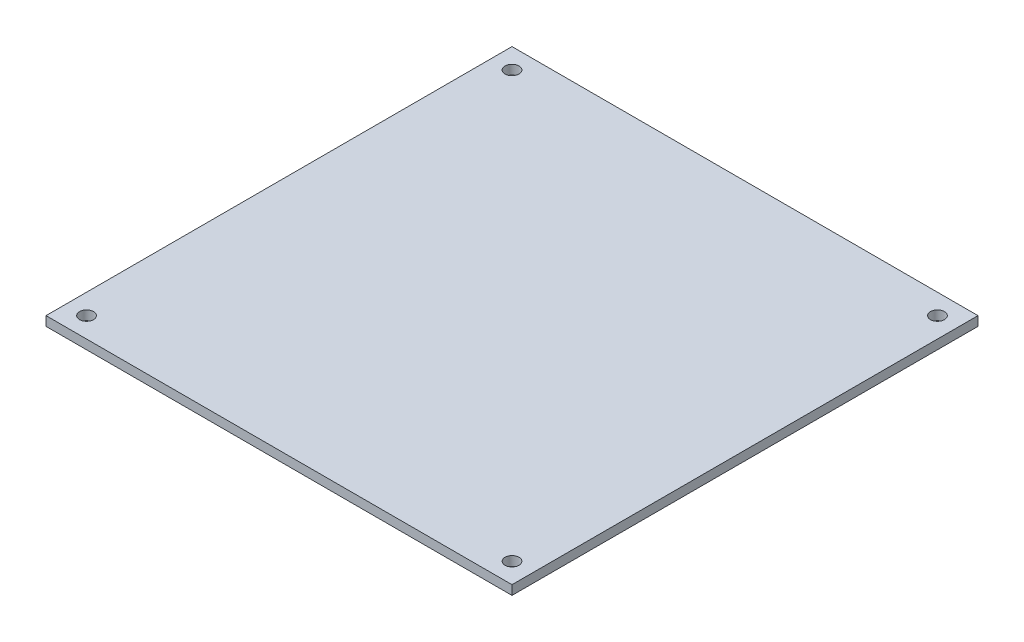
SolidWorks part; units mm, degrees
ref_plane "Front Plane" through (0, 0, 0) normal (0, 0, 1) x (1, 0, 0)
ref_plane "Top Plane" through (0, 0, 0) normal (0, 1, 0) x (1, 0, 0)
ref_plane "Right Plane" through (0, 0, 0) normal (1, 0, 0) x (0, 0, -1)
sketch "Esquisse1" plane through (0, 0, 0) normal (0, 1, 0) x (1, 0, 0)
  line L0 (-50.5021, 48.8702) -> (-50.5021, -51.1298)
  line L1 (-50.5021, -51.1298) -> (49.4979, -51.1298)
  line L2 (49.4979, -51.1298) -> (49.4979, 48.8702)
  line L3 (49.4979, 48.8702) -> (-50.5021, 48.8702)
  circle A0 centre (45.1479, -46.7798) radius 1.5
  circle A1 centre (-46.1521, -46.7798) radius 1.5
  circle A2 centre (-46.1521, 44.5202) radius 1.5
  circle A3 centre (45.1479, 44.5202) radius 1.5
extrude "Boss.-Extru.1" add sketch "Esquisse1" along normal blind 2
